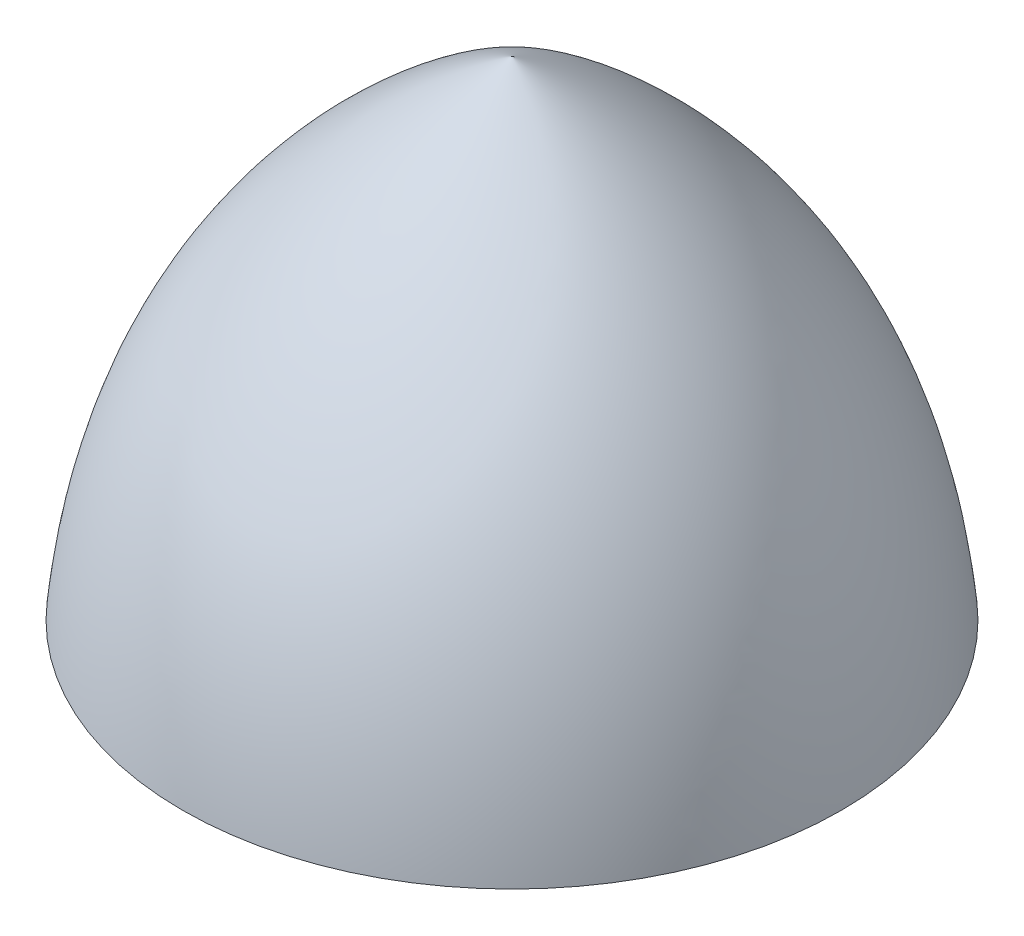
SolidWorks part; units mm, degrees
ref_plane "Alzado" through (0, 0, 0) normal (0, 0, 1) x (1, 0, 0)
ref_plane "Planta" through (0, 0, 0) normal (0, 1, 0) x (1, 0, 0)
ref_plane "Vista lateral" through (0, 0, 0) normal (1, 0, 0) x (0, 0, -1)
sketch "Croquis2" plane through (0, 0, 0) normal (0, 0, 1) x (1, 0, 0)
  line L0 (-23, -2.8845) -> (-21, -2.8845)
  line L1 (-2, 26.2238) -> (-2, 28.2238)
  spline S0 degree 2 poles (-23, -2.8845) (-20.9938, 18.322) (-2, 28.2238) knots 0 0 0 1 1 1
  spline S1 degree 2 poles (-21, -2.8845) (-19.9215, 17.4258) (-2, 26.2238) knots 0 0 0 1 1 1
  dimension "D3" = 18
  dimension "D1" = 23
  dimension "D2" = 15
  dimension "D4" = 15
  dimension "D5" = 13
  dimension "D6" = 2
  dimension "D7" = 2
revolve "Revolución1" add sketch "Croquis2" angle 360 about L1
